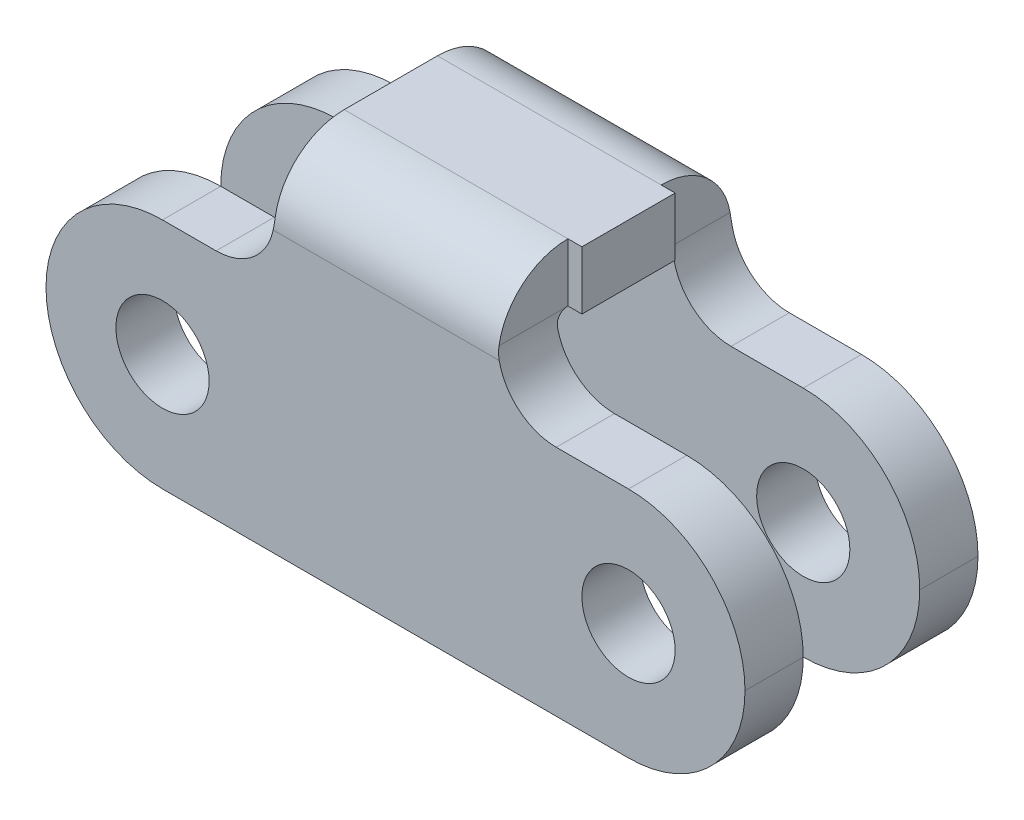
SolidWorks part; units mm, degrees
extrude "Base-Extrude" add sketch "Sketch1" against normal blind 12.7
sketch "Sketch1" plane through (0, 0, 0) normal (0, 0, 1) x (1, 0, 0)
  line L0 (0, 0) -> (43.438, 0) construction
  line L1 (-6.35, -6.35) -> (31.75, -6.35)
  line L2 (-6.35, -6.35) -> (-6.35, 12.7)
  line L3 (31.75, 12.7) -> (-6.35, 12.7)
  line L4 (31.75, 12.7) -> (31.75, -6.35)
  circle A0 centre (0, 0) radius 2.54
  circle A1 centre (25.4, 0) radius 2.54
  dimension "D1" = 5.08
  dimension "D2" = 25.4
  dimension "D3" = 38.1
  dimension "D4" = 19.05
  dimension "D5" = 6.35
  dimension "D6" = 6.35
ref_plane "Plane1" through (0, 0, 0) normal (0, 0, 1) x (1, 0, 0)
ref_plane "Plane2" through (0, 0, 0) normal (0, 1, 0) x (-1, 0, 0)
ref_plane "Plane3" through (0, 0, 0) normal (1, 0, 0) x (0, 0, -1)
sketch "Sketch3" plane through (31.75, 0, 0) normal (1, 0, 0) x (0, 0, -1)
  line L0 (3.175, -6.35) -> (3.175, 9.525)
  line L1 (12.7, -6.35) -> (0, -6.35) construction
  line L2 (3.175, 9.525) -> (9.525, 9.525)
  line L3 (9.525, 9.525) -> (9.525, -6.35)
  line L4 (0, 12.7) -> (0, -6.35) construction
  line L5 (12.7, 12.7) -> (0, 12.7) construction
  line L6 (12.7, 12.7) -> (12.7, -6.35) construction
extrude "Cut-Extrude1" cut sketch "Sketch3" against normal through all flip side to cut
sketch "Sketch4" plane through (0, 0, 0) normal (0, 0, 1) x (1, 0, 0)
  line L0 (-6.35, 6.35) -> (2.921, 6.35)
  line L1 (-6.35, -6.35) -> (-6.35, 12.7) construction
  line L2 (6.096, 9.525) -> (6.096, 12.7)
  line L3 (31.75, 12.7) -> (-6.35, 12.7) construction
  arc A0 (2.921, 6.35) -> (6.096, 9.525) centre (2.921, 9.525) ccw
  dimension "D3" = 3.175
  dimension "D1" = 6.35
  dimension "D2" = 12.446
extrude "Cut-Extrude2" cut sketch "Sketch4" against normal through all
sketch "Sketch5" plane through (0, 0, 0) normal (0, 0, 1) x (1, 0, 0)
  line L0 (31.75, 6.35) -> (21.463, 6.35)
  line L1 (31.75, 12.7) -> (31.75, -6.35) construction
  line L2 (18.288, 9.525) -> (18.288, 12.7)
  line L3 (31.75, 12.7) -> (6.096, 12.7) construction
  line L4 (-6.35, 6.35) -> (2.921, 6.35) construction
  arc A0 (21.463, 6.35) -> (18.288, 9.525) centre (21.463, 9.525) cw
  arc A1 (2.921, 6.35) -> (6.096, 9.525) centre (2.921, 9.525) ccw construction
  dimension "D1" = 12.192
extrude "Cut-Extrude3" cut sketch "Sketch5" against normal through all flip side to cut
fillet "Fillet1" radius 0.635 2 edges at (12.192, 9.525, -9.525) (12.192, 9.525, -3.175)
fillet "Fillet2" radius 3.81 6 edges at (6.096, 11.1125, -12.7) (6.096, 11.1125, 0) (12.192, 12.7, 0) (12.192, 12.7, -12.7) (18.288, 11.1125, 0) (18.288, 11.1125, -12.7)
fillet "Fillet3" radius 6.35 16 edges at (-6.35, -6.35, -1.5875) (31.75, -6.35, -1.5875) (-6.35, 0, -9.525) (31.75, 0, -3.175) (-6.35, 0, -12.7) (-6.35, 0, -3.175) (-6.35, 6.35, -1.5875) (-6.35, 6.35, -11.1125) (-6.35, 0, 0) (31.75, 0, -9.525) (31.75, 0, -12.7) (31.75, 0, 0) (31.75, 6.35, -11.1125) (-6.35, -6.35, -11.1125) (31.75, 6.35, -1.5875) (31.75, -6.35, -11.1125)
sketch "Sketch6" plane through (18.288, 0, 0) normal (1, 0, 0) x (0, 0, -1)
  line L0 (3.81, 12.7) -> (8.89, 12.7) construction
  line L1 (3.81, 12.7) -> (8.89, 12.7)
  line L2 (3.81, 9.525) -> (8.89, 9.525) construction
  line L3 (3.81, 9.525) -> (8.89, 9.525)
  line L4 (3.81, 12.7) -> (3.81, 9.525)
  line L5 (8.89, 12.7) -> (8.89, 9.525)
extrude "Boss-Extrude1" add sketch "Sketch6" along normal blind 0.762
equation "\"D2@Sketch3\" = \"D1@Sketch3\""
equation "\"D3@Sketch3\" = \"D1@Sketch3\""
